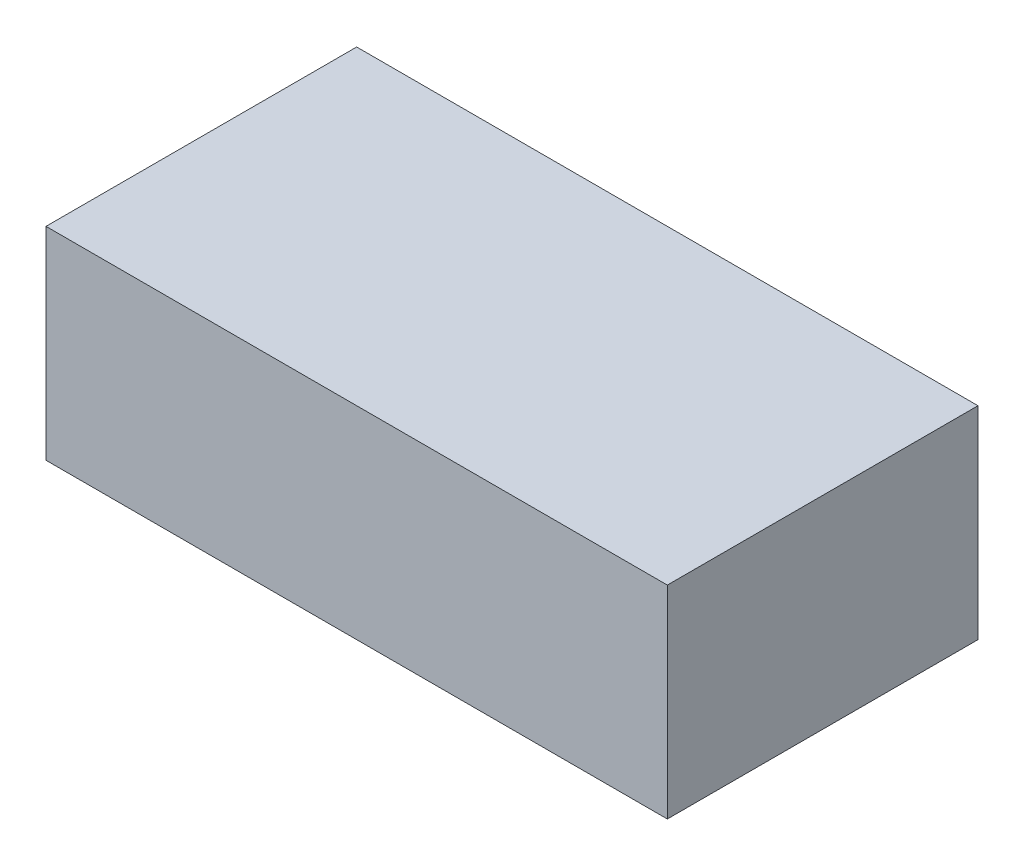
SolidWorks part; units mm, degrees
ref_plane "Front Plane" through (0, 0, 0) normal (0, 0, 1) x (1, 0, 0)
ref_plane "Top Plane" through (0, 0, 0) normal (0, 1, 0) x (1, 0, 0)
ref_plane "Right Plane" through (0, 0, 0) normal (1, 0, 0) x (0, 0, -1)
sketch "Sketch1" plane through (0, 0, 0) normal (0, 1, 0) x (1, 0, 0)
  line L1 (-115, 57.5) -> (115, 57.5)
  line L2 (-115, 57.5) -> (-115, -57.5)
  line L3 (-115, -57.5) -> (115, -57.5)
  line L4 (115, 57.5) -> (115, -57.5)
  line L5 (-115, 57.5) -> (115, -57.5) construction
  line L6 (-115, -57.5) -> (115, 57.5) construction
  point P0 (0, 0)
  dimension "D1" = 230
  dimension "D2" = 115
extrude "Boss-Extrude1" add sketch "Sketch1" along normal mid plane 75
